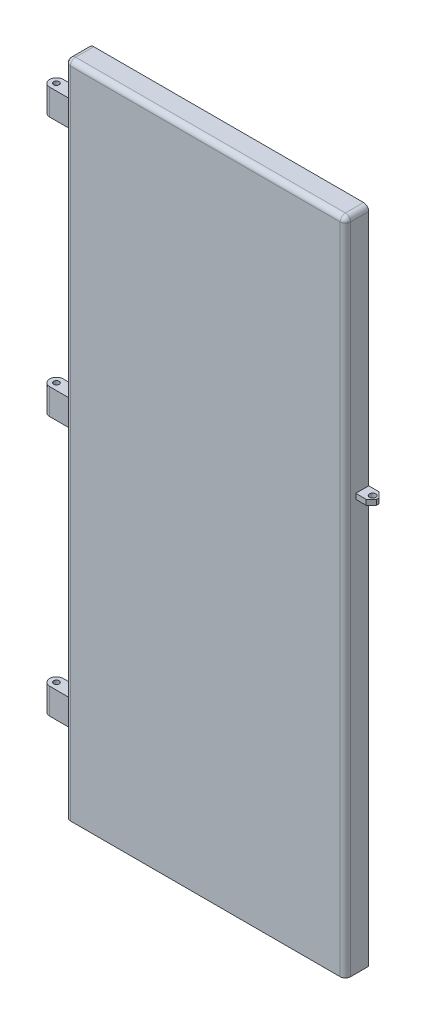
SolidWorks part; units mm, degrees
ref_plane "Plan de face" through (0, 0, 0) normal (0, 0, 1) x (1, 0, 0)
ref_plane "Plan de dessus" through (0, 0, 0) normal (0, 1, 0) x (1, 0, 0)
ref_plane "Plan de droite" through (0, 0, 0) normal (1, 0, 0) x (0, 0, -1)
sketch "Esquisse1" plane through (0, 0, 0) normal (0, 0, 1) x (1, 0, 0)
  line L1 (-270, -635) -> (270, -635)
  line L2 (-270, -635) -> (-270, 635)
  line L3 (-270, 635) -> (270, 635)
  line L4 (270, -635) -> (270, 635)
  line L5 (-270, -635) -> (270, 635) construction
  line L6 (-270, 635) -> (270, -635) construction
  point P0 (0, 0)
  dimension "D1" = 1270
  dimension "D2" = 540
extrude "Boss.-Extru.1" add sketch "Esquisse1" along normal blind 45
fillet "Congé1" radius 10 5 edges at (-270, 0, 45) (0, 635, 45) (270, 0, 45) (-270, 635, 22.5) (270, 635, 22.5)
shell "Coque1" thickness 2
ref_plane "Plan1" through (0, 560, 0) normal (0, 1, 0) x (1, 0, 0)
sketch "Esquisse2" plane through (0, 560, 0) normal (0, 1, 0) x (1, 0, 0)
  line L1 (-310, -35) -> (-270, -35)
  line L3 (-310, -9) -> (-270, -9)
  line L4 (-270, -35) -> (-270, -9)
  arc A0 (-310, -9) -> (-310, -35) centre (-310, -22) ccw
  circle A1 centre (-310, -22) radius 5.25
  dimension "D1" = 40
  dimension "D2" = 13
  dimension "D3" = 10.5
extrude "Boss.-Extru.2" add sketch "Esquisse2" against normal blind 50
pattern_linear "Répétition linéaire1" count 3 spacing 500 along (0, -1, 0) of "Boss.-Extru.2"
sketch "Esquisse3" plane through (270, 0, 0) normal (1, 0, 0) x (0, 0, -1)
  line L0 (0, -635) -> (0, 625) construction
  line L1 (0, 167) -> (-25, 167)
  line L2 (0, 167) -> (0, 157)
  line L3 (0, 157) -> (-25, 157)
  line L4 (-25, 167) -> (-25, 157)
  line L5 (-35, -635) -> (0, -635) construction
  point P6 (-17.5, -635)
  dimension "D1" = 10
  dimension "D2" = 25
  dimension "D3" = 792
extrude "Boss.-Extru.3" add sketch "Esquisse3" along normal blind 30
sketch "Esquisse4" plane through (0, 167, 0) normal (0, 1, 0) x (1, 0, 0)
  line L0 (300, 0) -> (270, 0) construction
  line L1 (270, 0) -> (270, -25) construction
  circle A0 centre (290, -12.5) radius 6
  dimension "D1" = 12
  dimension "D2" = 12.5
  dimension "D3" = 20
extrude "Enlèv. mat.-Extru.1" cut sketch "Esquisse4" against normal up to surface (10 mm away)
chamfer "Chanfrein1" distance 10 angle 45 2 edges at (300, 162, 0) (300, 162, 25)
sketch "Esquisse5" plane through (268, 0, 0) normal (-1, 0, 0) x (0, 0, 1)
  line L0 (35, -635) -> (0, -635) construction
  line L1 (0, -635) -> (0, 625) construction
  circle A0 centre (15, 415) radius 6
  circle A1 centre (15, 65) radius 6
  circle A2 centre (15, -285) radius 6
  dimension "D2" = 350
  dimension "D3" = 350
  dimension "D4" = 15
  dimension "D5" = 12
  dimension "D1" = 350
extrude "Boss.-Extru.4" add sketch "Esquisse5" along normal blind 531
